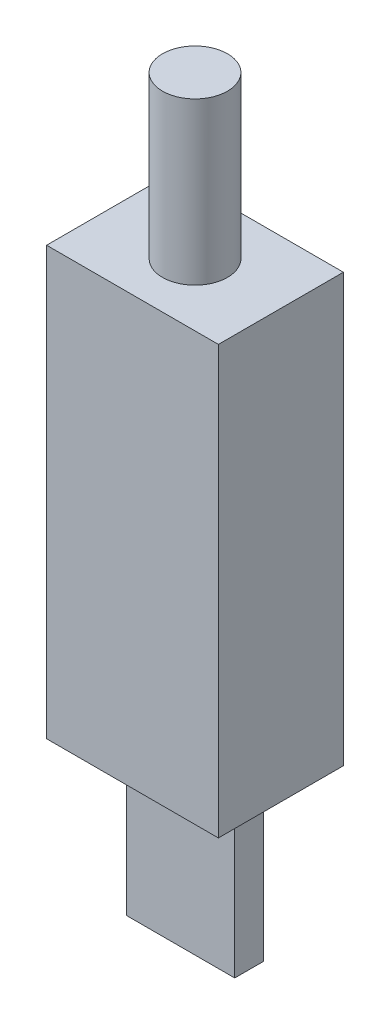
SolidWorks part; units mm, degrees
ref_plane "Front Plane" through (0, 0, 0) normal (0, 0, 1) x (1, 0, 0)
ref_plane "Top Plane" through (0, 0, 0) normal (0, 1, 0) x (1, 0, 0)
ref_plane "Right Plane" through (0, 0, 0) normal (1, 0, 0) x (0, 0, -1)
sketch "Sketch1" plane through (0, 0, 0) normal (0, 1, 0) x (1, 0, 0)
  line L1 (0, 0) -> (6.8072, 0)
  line L2 (0, 0) -> (0, 1.8034)
  line L3 (0, 1.8034) -> (6.8072, 1.8034)
  line L4 (6.8072, 0) -> (6.8072, 1.8034)
  dimension "D1" = 6.8072
  dimension "D2" = 1.8034
extrude "Boss-Extrude1" add sketch "Sketch1" along normal blind 10.16
sketch "Sketch2" plane through (0, 10.16, 0) normal (0, 1, 0) x (1, 0, 0)
  line L0 (0, 0) -> (0, -3.0353) construction
  line L1 (-2.0066, -3.0353) -> (8.8138, -3.0353)
  line L2 (-2.0066, -3.0353) -> (-2.0066, 4.8387)
  line L3 (-2.0066, 4.8387) -> (8.8138, 4.8387)
  line L4 (8.8138, -3.0353) -> (8.8138, 4.8387)
  line L5 (0, 0) -> (-2.0066, 0) construction
  line L6 (6.8072, 1.8034) -> (6.8072, 4.8387) construction
  line L7 (6.8072, 1.8034) -> (8.8138, 1.8034) construction
  dimension "D1" = 7.874
  dimension "D2" = 10.8204
extrude "Boss-Extrude2" add sketch "Sketch2" along normal blind 26.924
sketch "Sketch3" plane through (0, 37.084, 0) normal (0, 1, 0) x (1, 0, 0)
  line L0 (8.8138, 4.8387) -> (-2.0066, 4.8387) construction
  line L1 (-2.0066, 4.8387) -> (-2.0066, -3.0353) construction
  circle A0 centre (3.4036, 0.9017) radius 2.0447
  point P5 (3.4036, 4.8387)
  point P9 (-2.0066, 0.9017)
  dimension "D1" = 4.0894
extrude "Boss-Extrude3" add sketch "Sketch3" along normal blind 10.16
